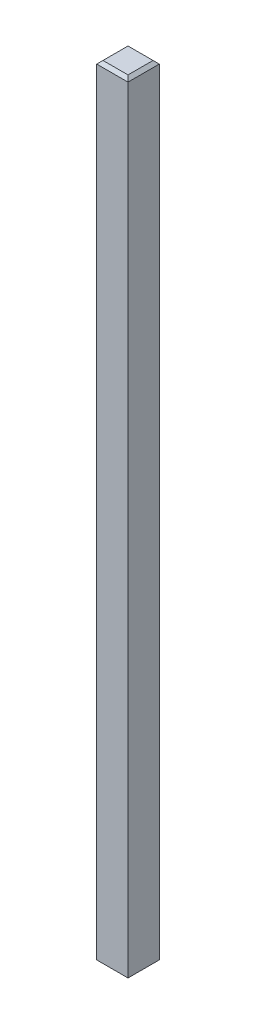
SolidWorks part; units mm, degrees
ref_plane "Plan de face" through (0, 0, 0) normal (0, 0, 1) x (1, 0, 0)
ref_plane "Plan de dessus" through (0, 0, 0) normal (0, 1, 0) x (1, 0, 0)
ref_plane "Plan de droite" through (0, 0, 0) normal (1, 0, 0) x (0, 0, -1)
sketch "Esquisse1" plane through (0, 0, 0) normal (0, 0, 1) x (1, 0, 0)
  line L1 (0, 0) -> (10, 0)
  line L2 (0, 0) -> (0, 250)
  line L3 (0, 250) -> (10, 250)
  line L4 (10, 0) -> (10, 250)
  dimension "D1" = 250
  dimension "D2" = 10
extrude "Boss.-Extru.1" add sketch "Esquisse1" along normal blind 10
chamfer "Chanfrein1" distance 1 angle 45 8 edges at (10, 250, 5) (5, 250, 10) (0, 250, 5) (5, 250, 0) (0, 0, 5) (5, 0, 10) (10, 0, 5) (5, 0, 0)
